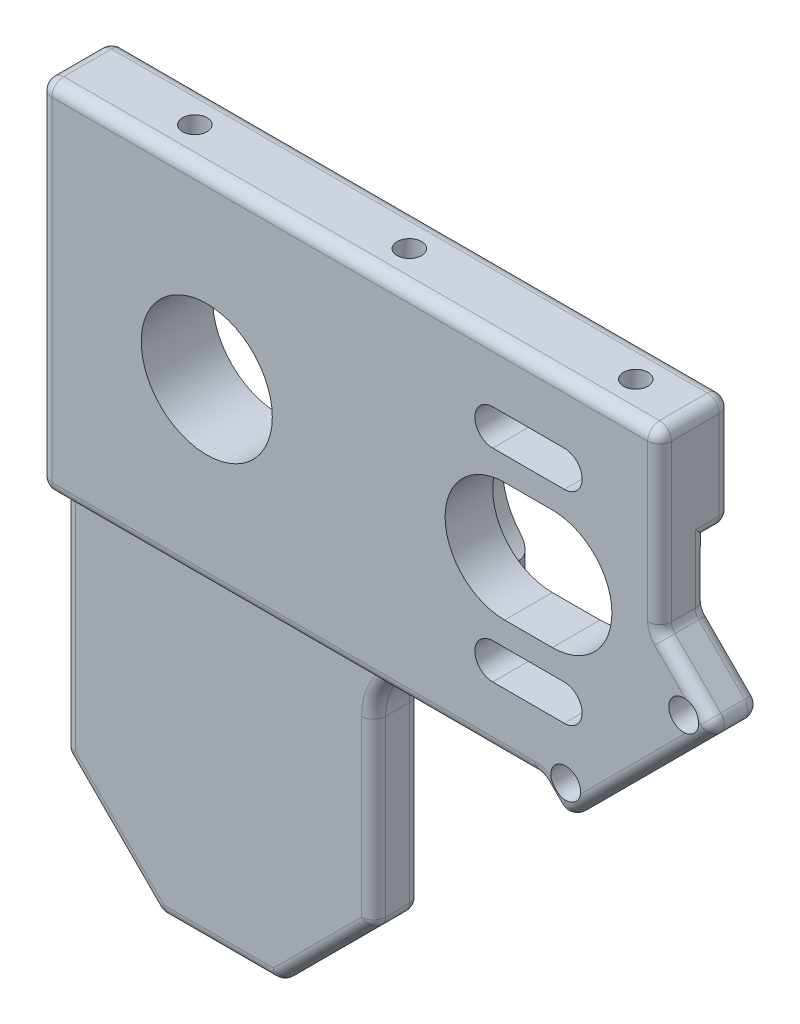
SolidWorks part; units mm, degrees
ref_plane "前视基准面" through (0, 0, 0) normal (0, 0, 1) x (1, 0, 0)
ref_plane "上视基准面" through (0, 0, 0) normal (0, 1, 0) x (1, 0, 0)
ref_plane "右视基准面" through (0, 0, 0) normal (1, 0, 0) x (0, 0, -1)
other "Configuration Table"
sketch "草图1" plane through (0, 0, 0) normal (0, 0, 1) x (1, 0, 0)
  line L0 (0, 0) -> (0, -50)
  line L1 (8, -58) -> (18, -58)
  line L2 (26, -50) -> (26, -30)
  line L3 (26, -30) -> (42, -30)
  line L4 (42, -30) -> (44.1213, -32.1213)
  line L5 (44.1213, -32.1213) -> (56.8492, -19.3934)
  line L6 (56.8492, -19.3934) -> (52, -14.5442)
  line L7 (52, -14.5442) -> (52, 0)
  line L8 (52, 0) -> (0, 0)
  line L9 (13, -58) -> (13, 0) construction
  line L10 (0, -50) -> (8, -58)
  line L11 (26, -50) -> (18, -58)
  line L12 (0, -15) -> (52, -15) construction
  line L13 (39, -15) -> (43, -15) construction
  line L14 (39, -10) -> (43, -10)
  line L15 (39, -20) -> (43, -20)
  line L16 (38, -6.5) -> (44, -6.5) construction
  line L17 (38, -5) -> (44, -5)
  line L18 (38, -8) -> (44, -8)
  line L19 (38, -23.5) -> (44, -23.5) construction
  line L20 (38, -25) -> (44, -25)
  line L21 (38, -22) -> (44, -22)
  arc A0 (39, -10) -> (39, -20) centre (39, -15) ccw
  arc A1 (43, -20) -> (43, -10) centre (43, -15) ccw
  arc A2 (38, -5) -> (38, -8) centre (38, -6.5) ccw
  arc A3 (44, -8) -> (44, -5) centre (44, -6.5) ccw
  arc A4 (38, -25) -> (38, -22) centre (38, -23.5) cw
  arc A5 (44, -22) -> (44, -25) centre (44, -23.5) cw
  circle A6 centre (44.1213, -29.2929) radius 1.25
  circle A7 centre (54.0208, -19.3934) radius 1.25
  circle A8 centre (14, -15) radius 5.5
  point P16 (41, -15)
  point P23 (41, -6.5)
  point P30 (48, -15)
  point P33 (41, -23.5)
  dimension "D19" = 2.5
  dimension "D23" = 2.5
  dimension "D25" = 11
  dimension "D1" = 52
  dimension "D2" = 58
  dimension "D3" = 45
  dimension "D4" = 45
  dimension "D5" = 10
  dimension "D6" = 50
  dimension "D7" = 50
  dimension "D8" = 16
  dimension "D9" = 30
  dimension "D10" = 3
  dimension "D11" = 18
  dimension "D12" = 15
  dimension "D13" = 10
  dimension "D14" = 4
  dimension "D15" = 4
  dimension "D16" = 3
  dimension "D17" = 6
  dimension "D18" = 5
  dimension "D20" = 2
  dimension "D21" = 2
  dimension "D22" = 2
  dimension "D24" = 2
  dimension "D26" = 14
extrude "凸台-拉伸1" add sketch "草图1" along normal blind 6
sketch "草图3" plane through (0, 0, 6) normal (0, 0, 1) x (1, 0, 0)
  line L0 (26, -30) -> (0, -30)
  line L11 (52, 0) -> (0, 0)
  line L12 (0, 0) -> (0, -50)
  line L13 (0, -50) -> (8, -58)
  line L14 (8, -58) -> (18, -58)
  line L15 (18, -58) -> (26, -50)
  line L16 (26, -50) -> (26, -30)
  line L17 (26, -30) -> (42, -30)
  line L18 (42, -30) -> (44.1213, -32.1213)
  line L19 (44.1213, -32.1213) -> (56.8492, -19.3934)
  line L20 (56.8492, -19.3934) -> (52, -14.5442)
  line L21 (52, -14.5442) -> (52, 0)
  line L23 (0, -30) -> (0, -50)
  line L24 (0, -50) -> (8, -58)
  line L25 (8, -58) -> (18, -58)
  line L26 (18, -58) -> (26, -50)
  line L27 (26, -50) -> (26, -30)
  dimension "D1" = 0
extrude "切除-拉伸2" cut sketch "草图3" against normal blind 2
sketch "草图4" plane through (0, 0, 0) normal (0, 0, -1) x (-1, 0, 0)
  line L0 (-35.2997, -3.7733) -> (-35.2997, -10.0362)
  line L2 (-35.2997, -19.9638) -> (-35.2997, -30)
  line L3 (-26, -30) -> (-42, -30) construction
  line L4 (-52, -14.5442) -> (-52, 0) construction
  line L5 (-56.8492, -19.3934) -> (-52, -14.5442) construction
  line L6 (-44.1213, -32.1213) -> (-56.8492, -19.3934) construction
  line L7 (-42, -30) -> (-44.1213, -32.1213) construction
  line L9 (-52, -14.5442) -> (-52, -9.4428)
  line L10 (-56.8492, -19.3934) -> (-52, -14.5442)
  line L11 (-44.1213, -32.1213) -> (-56.8492, -19.3934)
  line L12 (-42, -30) -> (-44.1213, -32.1213)
  line L13 (-35.2997, -30) -> (-42, -30)
  line L14 (-52, -9.4428) -> (-46.7382, -9.4428)
  line L15 (-46.7382, -9.4428) -> (-46.7382, -3.7733)
  line L16 (-46.7382, -3.7733) -> (-35.2997, -3.7733)
  arc A0 (-35.2997, -19.9638) -> (-35.2997, -10.0362) centre (-39, -15) ccw
extrude "切除-拉伸3" cut sketch "草图4" against normal blind 2
hole_wizard "M2.5 螺纹孔1" positions "草图5" profile "草图6" tap size "M2.5" standard "GB"
sketch "草图5" plane through (0, 0, 0) normal (0, 1, 0) x (1, 0, 0)
  line L0 (52, 0) -> (0, 0) construction
  line L1 (0, -6) -> (0, 0) construction
  line L2 (52, -6) -> (52, -2) construction
  point P0 (10, -3)
  point P2 (28, -3)
  point P4 (47, -3)
  dimension "D1" = 3
  dimension "D2" = 10
  dimension "D3" = 5
  dimension "D4" = 24
sketch "草图6" plane through (10, 0, 3) normal (1, 0, 0) x (0, 0, 1)
  line L0 (0, 0) -> (0, 3.5159)
  line L1 (0, 3.5159) -> (1.025, 2.9)
  line L2 (1.025, 2.9) -> (1.025, 0)
  line L5 (1.025, 0) -> (0, 0)
  line L10 (0, 3.5159) -> (-1.025, 2.9) construction
  line L11 (0, -6.35) -> (0, 107.95) construction
  dimension "螺纹孔钻头直径" = 2.05
  dimension "螺纹孔钻头深度" = 2.9
  dimension "导头角度" = 118
hole_wizard "M2.5 螺纹孔2" positions "草图7" profile "草图8" tap size "M2.5" standard "GB"
sketch "草图7" plane through (0, 0, 0) normal (-1, 0, 0) x (0, 0, 1)
  line L0 (6, 0) -> (6, -30) construction
  line L1 (6, 0) -> (0, 0) construction
  point P0 (3, -20)
  dimension "D1" = 3
  dimension "D2" = 20
sketch "草图8" plane through (0, -20, 3) normal (0, 1, 0) x (0, 0, 1)
  line L0 (0, 0) -> (0, 3.5159)
  line L1 (0, 3.5159) -> (1.025, 2.9)
  line L2 (1.025, 2.9) -> (1.025, 0)
  line L5 (1.025, 0) -> (0, 0)
  line L10 (0, 3.5159) -> (-1.025, 2.9) construction
  line L11 (0, -6.35) -> (0, 107.95) construction
  dimension "螺纹孔钻头直径" = 2.05
  dimension "螺纹孔钻头深度" = 2.9
  dimension "导头角度" = 118
fillet "圆角1" radius 1 16 edges at (0, -30, 5) (35.2997, -3.7733, 1) (46.7382, -3.7733, 1) (35.2997, -30, 1) (46.7382, -9.4428, 1) (52, -9.4428, 1) (42, -30, 4) (44.1213, -32.1213, 4) (52, -14.5442, 4) (56.8492, -19.3934, 4) (52, 0, 3) (0, 0, 3) (26, -50, 2) (18, -58, 2) (8, -58, 2) (0, -50, 2)
fillet "圆角2" radius 5 1 edges at (26, -30, 2)
fillet "圆角3" radius 1 58 edges at (52, -11.2864, 2) (52.0761, -14.5126, 2) (54.2175, -16.7617, 2) (56.435, -19.3934, 2) (37.9428, -30, 2) (41.9685, -30.0761, 2) (42.8536, -30.8536, 2) (44.1213, -31.7071, 2) (51.7071, -0.2929, 6) (52, -7.565, 6) (52.0761, -14.5126, 6) (54.2175, -16.7617, 6) (56.435, -19.3934, 6) (50.4853, -25.7574, 6) (44.1213, -31.7071, 6) (42.8536, -30.8536, 6) (41.9685, -30.0761, 6) (21.2929, -30, 6) (0.2929, -29.7071, 6) (0, -15, 6) (0.2929, -0.2929, 6) (27.4645, -31.4645, 4) (26, -42.2929, 4) (25.9239, -49.9685, 4) (22, -54, 4) (17.9685, -57.9239, 4) (13, -58, 4) (8.0315, -57.9239, 4) (4, -54, 4) (0.0761, -49.9685, 4) (35.2997, -7.4047, 0) (35.5926, -4.0662, 0) (41.019, -3.7733, 0) (46.4453, -4.0662, 0) (46.7382, -6.608, 0) (47.0311, -9.1499, 0) (49.3691, -9.4428, 0) (51.7071, -9.1499, 0) (52, -4.7214, 0) (51.7071, -0.2929, 0) (26, 0, 0) (0.2929, -0.2929, 0) (35.2997, -24.4819, 0) (35.0068, -29.7071, 0) (32.6499, -30, 0) (27.4645, -31.4645, 0) (26, -42.2929, 0) (25.9239, -49.9685, 0) (22, -54, 0) (17.9685, -57.9239, 0) (13, -58, 0) (8.0315, -57.9239, 0) (4, -54, 0) (0.0761, -49.9685, 0) (50.4853, -25.7574, 2) (26, 0, 6) (0, -39.2929, 4) (0, -25.2929, 0)
